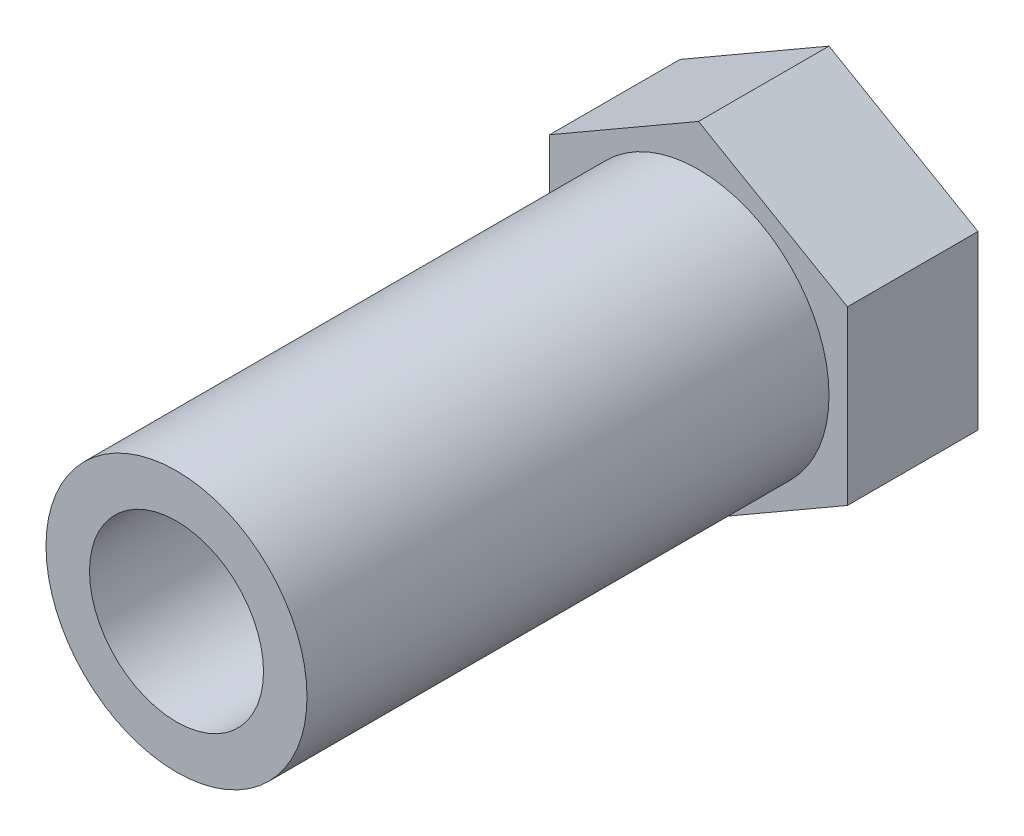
SolidWorks part; units mm, degrees
ref_plane "前视基准面" through (0, 0, 0) normal (0, 0, 1) x (1, 0, 0)
ref_plane "上视基准面" through (0, 0, 0) normal (0, 1, 0) x (1, 0, 0)
ref_plane "右视基准面" through (0, 0, 0) normal (1, 0, 0) x (0, 0, -1)
sketch "草图1" plane through (0, 0, 0) normal (0, 0, 1) x (1, 0, 0)
  line L1 (0, 7.9097) -> (-6.85, 3.9548)
  line L2 (-6.85, 3.9548) -> (-6.85, -3.9548)
  line L3 (-6.85, -3.9548) -> (0, -7.9097)
  line L4 (0, -7.9097) -> (6.85, -3.9548)
  line L5 (6.85, -3.9548) -> (6.85, 3.9548)
  line L6 (6.85, 3.9548) -> (0, 7.9097)
  circle A0 centre (0, 0) radius 6.85 construction
  dimension "D1" = 13.7
extrude "凸台-拉伸1" add sketch "草图1" along normal blind 6
sketch "草图2" plane through (0, 0, 6) normal (0, 0, 1) x (1, 0, 0)
  circle A0 centre (0, 0) radius 6
  dimension "D1" = 12
extrude "凸台-拉伸2" add sketch "草图2" along normal blind 24
sketch "草图3" plane through (0, 0, 30) normal (0, 0, 1) x (1, 0, 0)
  circle A0 centre (0, 0) radius 4
  dimension "D1" = 8
extrude "切除-拉伸1" cut sketch "草图3" against normal blind 24
